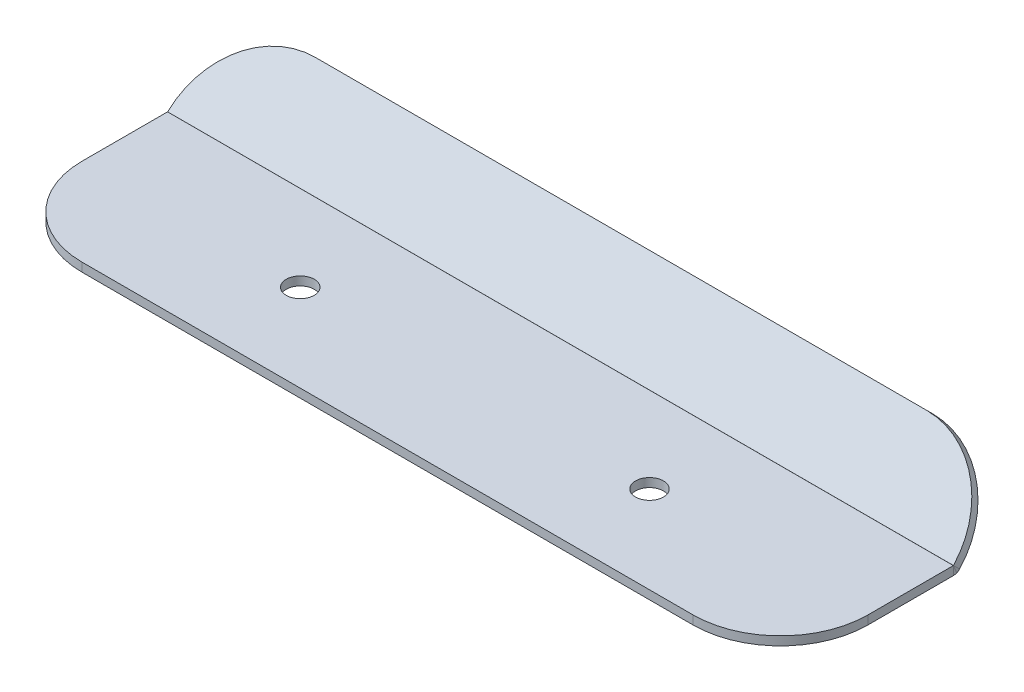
SolidWorks part; units mm, degrees
ref_plane "Front" through (0, 0, 0) normal (0, 0, 1) x (1, 0, 0)
ref_plane "Top" through (0, 0, 0) normal (0, 1, 0) x (1, 0, 0)
ref_plane "Right" through (0, 0, 0) normal (1, 0, 0) x (0, 0, -1)
sketch "Sketch1" plane through (0, 0, 0) normal (0, 1, 0) x (1, 0, 0)
  line L1 (10, 0) -> (80, 0)
  line L2 (0, 10) -> (0, 20)
  line L3 (10, 30) -> (80, 30)
  line L4 (90, 10) -> (90, 20)
  line L5 (45, 0) -> (45, 30) construction
  circle A0 centre (65, 10) radius 1.6
  circle A1 centre (25, 10) radius 1.6
  arc A2 (90, 20) -> (80, 30) centre (80, 20) ccw
  arc A3 (0, 20) -> (10, 30) centre (10, 20) cw
  arc A4 (10, 0) -> (0, 10) centre (10, 10) cw
  arc A5 (90, 10) -> (80, 0) centre (80, 10) cw
  point P17 (0, 0)
  dimension "D1" = 40
sheet metal parameters "Sheet-Metal1" thickness 1 parameters "D1"=0.01
base flange "Base-Flange1" sketch "Sketch1" thickness 1 reverse thickness direction yes parameters "D1"=0.01
sketch "Sketch3" plane through (0, 1, 0) normal (0, 1, 0) x (-1, 0, 0)
  line L1 (-10, -20) -> (-80, -20)
sketched bend "Sketched Bend1" parameters "D1"=0.7366
bend "SketchBend1" bend radius 0.01 bend angle 45 parameters "D5"=1
flat pattern "Flat-Pattern1"
sketch "Bend-Lines1" plane through (0, 1, 0) normal (0, 1, 0) x (-1, 0, 0)
  line L0 (-90, -20) -> (0, -20) construction
bend of the flat pattern "Flatten-<SketchBend1>1"
